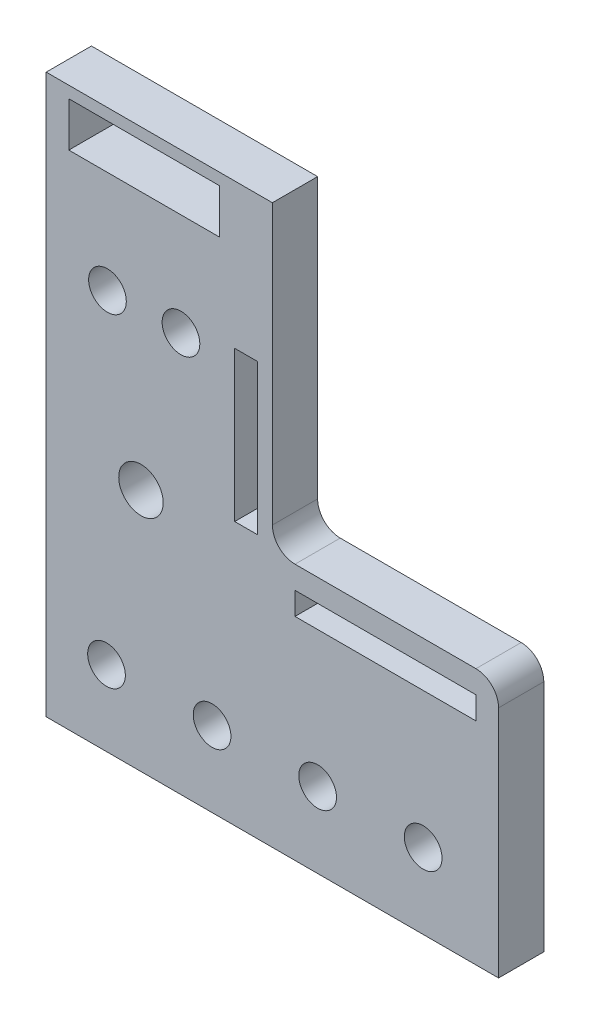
SolidWorks part; units mm, degrees
ref_plane "Front Plane" through (0, 0, 0) normal (0, 0, 1) x (1, 0, 0)
ref_plane "Top Plane" through (0, 0, 0) normal (0, 1, 0) x (1, 0, 0)
ref_plane "Right Plane" through (0, 0, 0) normal (1, 0, 0) x (0, 0, -1)
sketch "Sketch1" plane through (0, 0, 0) normal (0, 0, 1) x (1, 0, 0)
  line L0 (-328.0287, 66.7515) -> (-328.0287, -7.3014)
  line L1 (-328.0287, -7.3014) -> (-268.0287, -7.3014)
  line L2 (-268.0287, -7.3014) -> (-268.0287, 23.7305)
  line L3 (-271.0287, 26.7305) -> (-295.0287, 26.7305)
  line L4 (-298.0287, 29.7305) -> (-298.0287, 66.7515)
  line L5 (-298.0287, 66.7515) -> (-328.0287, 66.7515)
  line L6 (-325.0287, 65.1958) -> (-325.0287, 59.2958)
  line L7 (-325.0287, 59.2958) -> (-305.0287, 59.2958)
  line L8 (-305.0287, 59.2958) -> (-305.0287, 65.1958)
  line L9 (-305.0287, 65.1958) -> (-325.0287, 65.1958)
  line L10 (-303.0287, 47.5295) -> (-300.0287, 47.5295)
  line L11 (-300.0287, 47.5295) -> (-300.0287, 27.6308)
  line L12 (-300.0287, 27.6308) -> (-303.0287, 27.6308)
  line L13 (-303.0287, 27.6308) -> (-303.0287, 47.5295)
  line L15 (-271.0287, 23.7305) -> (-295.0287, 23.7305)
  line L16 (-271.0287, 23.7305) -> (-271.0287, 20.7305)
  line L17 (-271.0287, 20.7305) -> (-295.0287, 20.7305)
  line L18 (-295.0287, 23.7305) -> (-295.0287, 20.7305)
  arc A0 (-268.0287, 23.7305) -> (-271.0287, 26.7305) centre (-271.0287, 23.7305) ccw
  arc A1 (-295.0287, 26.7305) -> (-298.0287, 29.7305) centre (-295.0287, 29.7305) cw
  circle A2 centre (-320.0287, 2.6986) radius 2.5
  circle A3 centre (-306.0287, 2.6986) radius 2.5
  circle A4 centre (-292.0287, 2.6986) radius 2.5
  circle A5 centre (-278.0287, 2.6986) radius 2.5
  circle A6 centre (-319.9037, 45.727) radius 2.5
  circle A7 centre (-310.1537, 45.727) radius 2.5
  dimension "D1" = 3
  dimension "D2" = 3
extrude "Boss-Extrude1" add sketch "Sketch1" along normal blind 6
sketch "Sketch2" plane through (0, 0, 0) normal (0, 0, -1) x (-1, 0, 0)
  circle A0 centre (315.4577, 25.0381) radius 2.95
extrude "Cut-Extrude1" cut sketch "Sketch2" against normal blind 1.5
sketch "Sketch3" plane through (0, 0, 0) normal (0, 0, -1) x (-1, 0, 0)
  circle A0 centre (315.4577, 25.0381) radius 2.95
extrude "Cut-Extrude2" cut sketch "Sketch3" against normal blind 10
